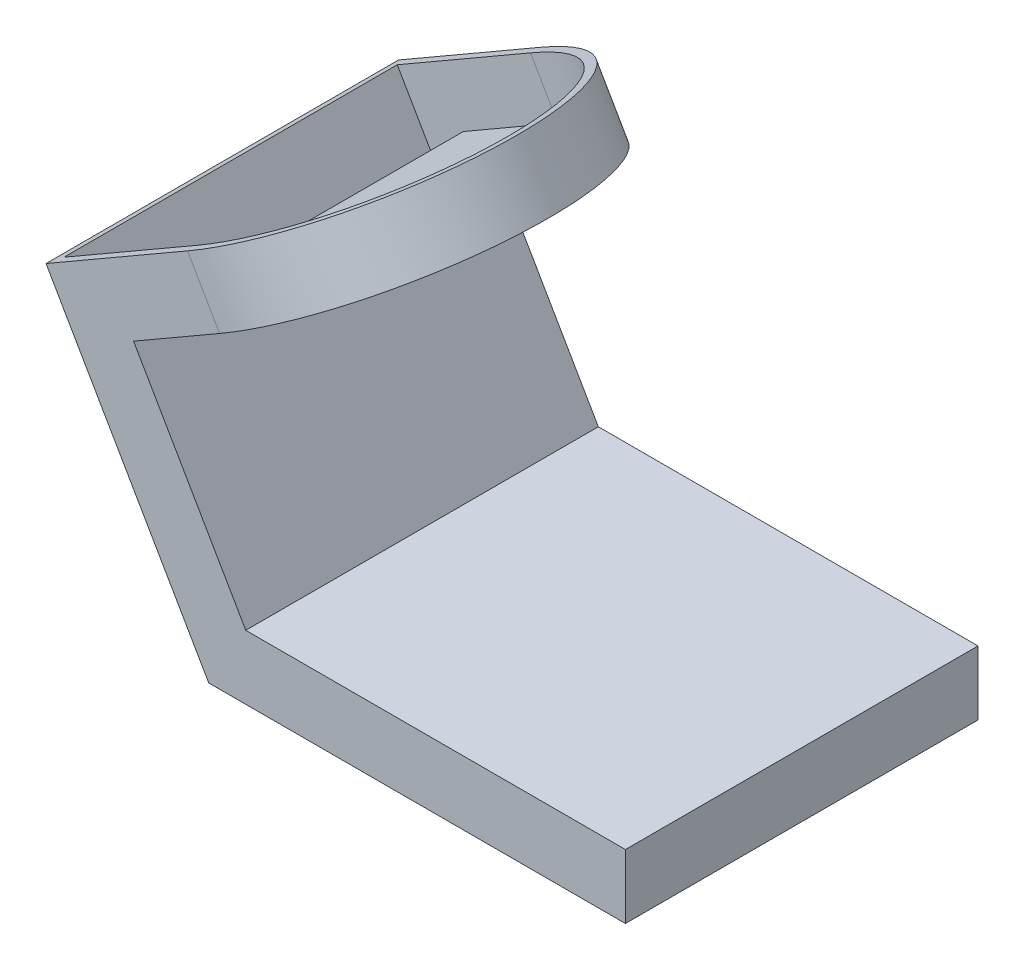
SolidWorks part; units mm, degrees
ref_plane "Alzado" through (0, 0, 0) normal (0, 0, 1) x (1, 0, 0)
ref_plane "Planta" through (0, 0, 0) normal (0, 1, 0) x (1, 0, 0)
ref_plane "Vista lateral" through (0, 0, 0) normal (1, 0, 0) x (0, 0, -1)
sketch "Croquis2" plane through (0, 0, 0) normal (0, 1, 0) x (1, 0, 0)
  line L1 (-65, 55) -> (65, 55)
  line L2 (-65, 55) -> (-65, -55)
  line L3 (-65, -55) -> (65, -55)
  line L4 (65, 55) -> (65, -55)
  line L5 (-65, 55) -> (65, -55) construction
  line L6 (-65, -55) -> (65, 55) construction
  point P0 (0, 0)
  dimension "D1" = 110
  dimension "D2" = 130
extrude "Saliente-Extruir1" add sketch "Croquis2" along normal blind 20
sketch "Croquis3" plane through (0, 0, 55) normal (0, 0, 1) x (1, 0, 0)
  line L0 (-53.453, 20) -> (-98.453, 97.9423)
  line L1 (-65, 20) -> (65, 20) construction
  line L2 (-65, 0) -> (65, 0) construction
  line L3 (-65, 0) -> (-115.7735, 87.9423)
  line L4 (-115.7735, 87.9423) -> (-98.453, 97.9423)
  line L5 (-70.7735, 10) -> (-115.7735, 87.9423) construction
  line L6 (-65, 20) -> (-65, 0) construction
  point P8 (0, 0)
  point P9 (-65, 0)
  dimension "D1" = 90
  dimension "D2" = 60
  dimension "D3" = 20
  dimension "D4" = 0
extrude "Extruir-Lámina1" add sketch "Croquis3" against normal through all thin
sketch "Croquis4" plane through (0, 0, 55) normal (0, 0, 1) x (1, 0, 0)
  line L0 (-115.7735, 87.9423) -> (-71.6062, 113.4423)
  line L1 (-115.7735, 87.9423) -> (-98.453, 97.9423) construction
  line L2 (-105.7735, 70.6218) -> (-61.6062, 96.1218)
  line L3 (-71.6062, 113.4423) -> (-61.6062, 96.1218)
  line L4 (-115.7735, 87.9423) -> (-105.7735, 70.6218)
  dimension "D1" = 51
  dimension "D2" = 0
  dimension "D3" = 20
extrude "Saliente-Extruir2" add sketch "Croquis4" against normal through all
sketch "Croquis5" plane through (-67.0235, 116.0881, 0) normal (-0.5, 0.866, 0) x (0.866, 0.5, 0)
  line L0 (-56.2917, -55) -> (49.7083, -55) construction
  line L1 (49.7083, -55) -> (-56.2917, -55) construction
  line L2 (49.7083, -55) -> (49.7083, 58.674) construction
  line L3 (-5.2917, 55) -> (-5.2917, -55)
  arc A0 (-5.2917, -55) -> (-5.2917, 55) centre (-5.2917, 0) ccw
  dimension "D1" = 106
extrude "Saliente-Extruir3" add sketch "Croquis5" against normal up to surface (20 mm away)
sketch "Croquis6" plane through (-67.0235, 116.0881, 0) normal (-0.5, 0.866, 0) x (0.866, 0.5, 0)
  line L0 (-56.2917, 55) -> (-56.2917, -55) construction
  line L1 (-56.2917, -55) -> (-5.2917, -55) construction
  circle A0 centre (-5.2917, 0) radius 9.5
  point P6 (-56.2917, 25.881)
  dimension "D1" = 19
  dimension "D2" = 51
  dimension "D3" = 55
extrude "Cortar-Extruir1" cut sketch "Croquis6" against normal up to surface (20 mm away)
shell "Vaciado1" thickness 3
sketch "Croquis7" plane through (-58.5235, 101.3657, 0) normal (-0.5, 0.866, 0) x (0.866, 0.5, 0)
  line L0 (-39.2917, -52) -> (-5.2917, -52) construction
  line L1 (-39.2917, 52) -> (-5.2917, 52) construction
  line L2 (-39.2917, 52) -> (-39.2917, -52) construction
  line L3 (-39.2917, -52) -> (-5.2917, -52)
  line L4 (-39.2917, 52) -> (-5.2917, 52)
  line L5 (-39.2917, 52) -> (-39.2917, -52)
  arc A0 (-5.2917, -52) -> (-5.2917, 52) centre (-5.2917, 0) ccw construction
  arc A1 (-5.2917, -52) -> (-5.2917, 52) centre (-5.2917, 0) ccw
extrude "Cortar-Extruir2" cut sketch "Croquis7" along normal blind 20
